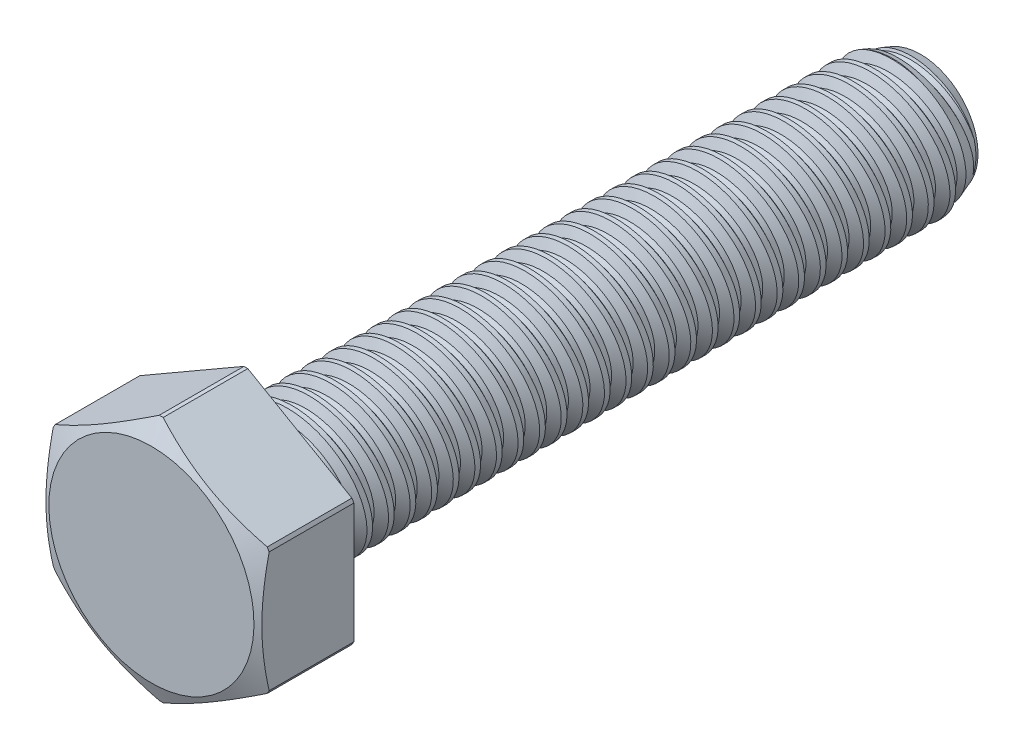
SolidWorks part; units mm, degrees
ref_plane "Front" through (0, 0, 0) normal (0, 0, 1) x (1, 0, 0)
ref_plane "Top" through (0, 0, 0) normal (0, 1, 0) x (1, 0, 0)
ref_plane "Right" through (0, 0, 0) normal (1, 0, 0) x (0, 0, -1)
sketch "Sketch1" plane through (0, 0, 0) normal (1, 0, 0) x (0, 0, -1)
  line L0 (-12.5, 0) -> (-16, 0) construction
  line L1 (-12.5, 0) -> (12.5, 0)
  line L2 (-12.5, 0) -> (-12.5, 2.5)
  line L3 (-12.5, 2.5) -> (12.5, 2.5)
  line L4 (12.5, 0) -> (12.5, 2.5)
  line L5 (-12.5, -2.5) -> (12.5, -2.5) construction
  dimension "D1" = 25
  dimension "Thread Dia" = 5
  dimension "Length" = 25
  dimension "Head Height" = 3.5
revolve "Revolve1" add sketch "Sketch1" angle 360 about L0
ref_plane "Plane1" through (0, 0, 16) normal (0, 0, 1) x (1, 0, 0)
sketch "Sketch2" plane through (0, 0, 0) normal (1, 0, 0) x (0, 0, -1)
  line L0 (-12.5, 2.5) -> (-12.5, -2.5) construction
  line L1 (-12.5, -2.5) -> (-11.7, -2.5) construction
  line L2 (-11.7, -2.5) -> (-12.5, 2.5) construction
  line L3 (-12.5, 2.5) -> (-12.4013, 2.5158) construction
  line L4 (-12.4013, 2.5158) -> (-11.71, 2.6264)
  line L5 (-11.71, 2.6264) -> (-11.8885, 2.1593)
  line L6 (-11.8885, 2.1593) -> (-12.086, 2.1277)
  line L7 (-12.086, 2.1277) -> (-12.4013, 2.5158)
  line L8 (-11.9872, 2.1435) -> (-12.0557, 2.5711) construction
  line L9 (-12.5, -2.5) -> (12.5, -2.5) construction
  line L10 (-12.5, 2.5) -> (12.5, 2.5) construction
  line L12 (-12.0443, 2.5) -> (-11.2443, -2.5) construction
  line L13 (-12.5, -0.1369) -> (-10.7886, 0.1369) construction
  line L15 (-12.5, 0) -> (-12.5, 2.5) construction
  point P19 (-11.6443, 0)
  dimension "D1" = 60
  dimension "Thread Pitch" = 0.8
  dimension "D2" = 0.1
  dimension "D3" = 0.2
  dimension "D4" = 0.8
revolve "Cut-Revolve1" cut sketch "Sketch2" angle 360 about L13
sketch "Sketch3" plane through (0, 0, 0) normal (1, 0, 0) x (0, 0, -1)
  line L0 (12.5, 2.1277) -> (11.4772, 2.5)
  line L1 (11.4772, 2.5) -> (12.5, 2.5)
  line L2 (12.5, 2.5) -> (12.5, 2.1277)
  line L3 (-12.5, 2.5) -> (12.5, 2.5) construction
  line L4 (12.5, 0) -> (12.5, 2.5) construction
  line L5 (11.4772, 0) -> (0, 0) construction
  line L6 (11.4772, 2.5) -> (11.4772, -2.5) construction
  line L7 (-12.5, -2.5) -> (12.5, -2.5) construction
  dimension "D1" = 20
  dimension "D2" = 5
revolve "Cut-Revolve2" cut sketch "Sketch3" angle 360 about L5
pattern_linear "LPattern1" count 31 spacing 0.8 along (0, 0, 1)
pattern_linear "LPattern2" count 2 spacing 0.8 along (0, 0, 1)
sketch "Sketch4" plane through (0, 0, 12.5) normal (0, 0, 1) x (1, 0, 0)
  line L1 (0, 4.6188) -> (-4, 2.3094)
  line L2 (-4, 2.3094) -> (-4, -2.3094)
  line L3 (-4, -2.3094) -> (0, -4.6188)
  line L4 (0, -4.6188) -> (4, -2.3094)
  line L5 (4, -2.3094) -> (4, 2.3094)
  line L6 (4, 2.3094) -> (0, 4.6188)
  circle A0 centre (0, 0) radius 4 construction
  circle A1 centre (0, 0) radius 4 construction
  dimension "Head Dia" = 8
extrude "Extrude1" add sketch "Sketch4" along normal up to surface (3.5 mm away)
sketch "Sketch9" plane through (0, 0, 0) normal (1, 0, 0) x (0, 0, -1)
  line L0 (-16, 3.8) -> (-15.6373, 4.5779)
  line L1 (-12.5, 4.6188) -> (-16, 4.6188)
  line L2 (-16, 4.6188) -> (-16, 3.8)
  line L3 (0, 0) -> (-16, 0) construction
  line L4 (-16, 4.6188) -> (-12.5, 4.6188) construction
  line L5 (-16, 2.3094) -> (-16, 4.6188) construction
  line L6 (-15.6373, 4.5779) -> (-12.5, 4.5779)
  line L10 (-12.5, 4.5779) -> (-12.5, 4.6188)
  line L11 (-12.5, 2.3094) -> (-12.5, 4.6188) construction
  dimension "D2" = 7.6
  dimension "D4" = 0.0409
  dimension "D1" = 25
  dimension "D3" = 0.8188
  dimension "D5" = 3.5
  dimension "D6" = 25
revolve "Cut-Revolve3" cut sketch "Sketch9" angle 360 about L3
equation "\"D2@Sketch2\"=\"Thread Pitch@Sketch2\"/8"
equation "\"D3@Sketch2\"=\"Thread Pitch@Sketch2\"/4"
equation "\"D4@Sketch2\"=\"Thread Pitch@Sketch2\""
equation "\"D3@LPattern1\"=\"Thread Pitch@Sketch2\""
equation "\"D1@LPattern1\"=\"D1@Sketch1\"/\"Thread Pitch@Sketch2\""
equation "\"D3@LPattern2\"=\"Thread Pitch@Sketch2\""
equation "\"D2@Sketch9\"=\"Head Dia@Sketch4\"*.95"
equation "\"D4@Sketch9\"=\"D3@Sketch9\"/20"
